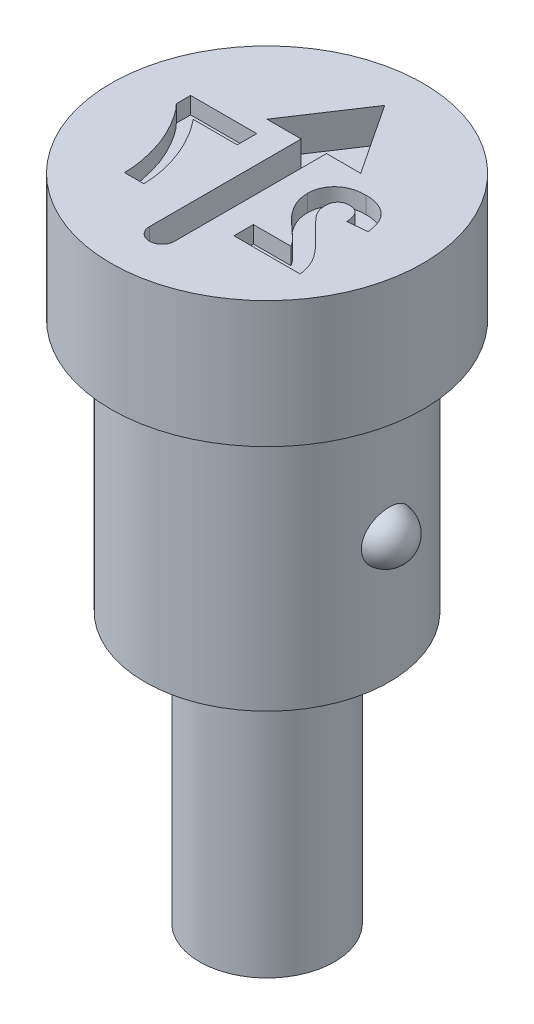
SolidWorks part; units mm, degrees
ref_plane "Front Plane" through (0, 0, 0) normal (0, 0, 1) x (1, 0, 0)
ref_plane "Top Plane" through (0, 0, 0) normal (0, 1, 0) x (1, 0, 0)
ref_plane "Right Plane" through (0, 0, 0) normal (1, 0, 0) x (0, 0, -1)
sketch "Sketch1" plane through (0, 0, 0) normal (0, 0, 1) x (1, 0, 0)
  line L0 (0, 0) -> (0, -7.7) construction
  line L1 (0, -2.035) -> (0, 2.035) construction
  line L2 (0, 0) -> (-1.85, 0)
  line L3 (-1.85, 0) -> (-1.85, -1.5)
  line L4 (-1.85, -1.5) -> (-1.45, -1.5)
  line L5 (-1.45, -1.5) -> (-1.45, -4.5)
  line L6 (-1.45, -4.5) -> (-0.8, -4.5)
  line L7 (-0.8, -4.5) -> (-0.8, -7.7)
  line L8 (-0.8, -7.7) -> (0, -7.7)
  line L9 (0, -7.7) -> (0, 0)
  dimension "D1" = 3.7
  dimension "D2" = 7.7
  dimension "D3" = 1.5
  dimension "D4" = 4.5
  dimension "D5" = 2.9
  dimension "D6" = 1.6
revolve "Revolve1" add sketch "Sketch1" angle 360 about L0
sketch "Sketch3" plane through (0, 0, 0) normal (0, 1, 0) x (1, 0, 0)
  line L0 (0, 1.395) -> (-0.556, 0.555)
  line L1 (-0.556, 0.555) -> (-0.15, 0.555)
  line L2 (-0.15, 0.555) -> (-0.15, -1.245)
  line L3 (0.15, -1.245) -> (0.15, 0.555)
  line L4 (0.15, 0.555) -> (0.556, 0.555)
  line L5 (0.556, 0.555) -> (0, 1.395)
  line L6 (0, 1.395) -> (0, -1.395) construction
  arc A0 (-0.15, -1.245) -> (0.15, -1.245) centre (0, -1.245) ccw
  dimension "D3" = 0.15
  dimension "D1" = 0.84
  dimension "D2" = 67
  dimension "D4" = 2.64
extrude "Cut-Extrude1" cut sketch "Sketch3" against normal blind 0.4
sketch "Sketch4" plane through (0, 0, 0) normal (0, 1, 0) x (1, 0, 0)
  text T0 "27" font "Arial" height 1.2
extrude "Cut-Extrude2" cut sketch "Sketch4" against normal blind 0.2
sketch "Sketch5" plane through (0, 0, 0) normal (0, 0, 1) x (1, 0, 0)
  line L2 (1.4051, -2.7) -> (1.4051, -3.3)
  line L3 (1.4051, -2.7) -> (1.4051, -3.3) construction
  line L4 (-1.45, -3) -> (1.4051, -3) construction
  line L5 (-1.45, -1.5) -> (-1.45, -4.5) construction
  arc A1 (1.4051, -3.3) -> (1.4051, -2.7) centre (1.4051, -3) ccw
  dimension "D1" = 0.3
revolve "Revolve2" add sketch "Sketch5" angle 360 about L2
